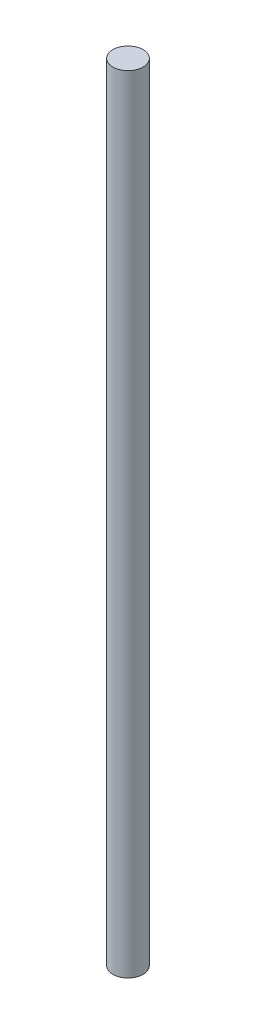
SolidWorks part; units mm, degrees
ref_plane "Front Plane" through (0, 0, 0) normal (0, 0, 1) x (1, 0, 0)
ref_plane "Top Plane" through (0, 0, 0) normal (0, 1, 0) x (1, 0, 0)
ref_plane "Right Plane" through (0, 0, 0) normal (1, 0, 0) x (0, 0, -1)
sketch "Sketch1" plane through (0, 0, 0) normal (0, 1, 0) x (1, 0, 0)
  circle A0 centre (0, 0) radius 3.175
extrude "Extrude1" add sketch "Sketch1" along normal blind 165.1
